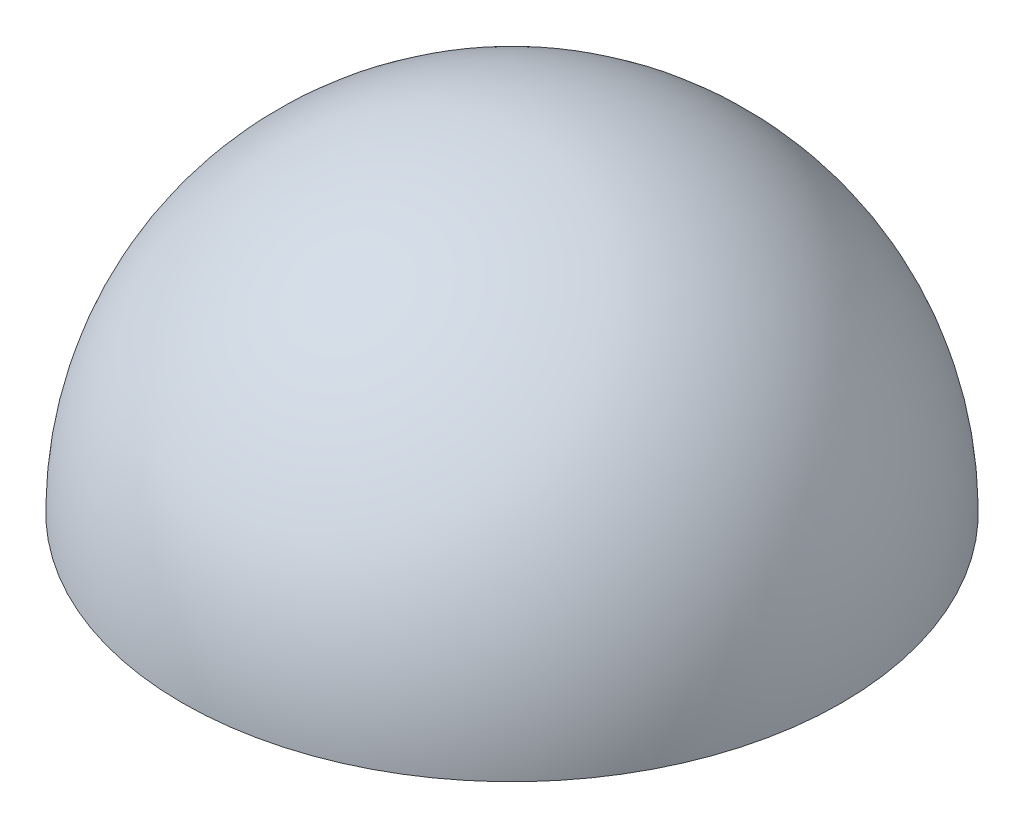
SolidWorks part; units mm, degrees
ref_plane "Front" through (0, 0, 0) normal (0, 0, 1) x (1, 0, 0)
ref_plane "Top" through (0, 0, 0) normal (0, 1, 0) x (1, 0, 0)
ref_plane "Right" through (0, 0, 0) normal (1, 0, 0) x (0, 0, -1)
sketch "Sketch1" plane through (0, 0, 0) normal (0, 0, 1) x (1, 0, 0)
  line L0 (0, 0) -> (0, -46.8792) construction
  line L1 (0, 0) -> (40.6911, 0)
  line L2 (0, 0) -> (0, 40.6911)
  arc A0 (40.6911, 0) -> (0, 40.6911) centre (0, 0) ccw
revolve "Revolve1" add sketch "Sketch1" angle 360 about L0
sketch "Sketch2" plane through (0, 0, 0) normal (0, -1, 0) x (1, 0, 0)
  line L3 (16.1696, -15.1011) -> (16.1696, 0)
  line L4 (21.2242, -15.1011) -> (21.2242, 0)
  dimension "D1" = 5.0546
sketch "Sketch3" plane through (0, 0, 0) normal (0, -1, 0) x (1, 0, 0)
  circle A0 centre (0, 0) radius 9.525
  dimension "D1" = 19.05
extrude "Cut-Extrude1" [suppressed] cut sketch "Sketch3" against normal through all
fillet "Fillet1" [suppressed] radius 1.27
sketch "Sketch4" plane through (0, 0, 0) normal (0, -1, 0) x (1, 0, 0)
  spline S0 degree 3 poles (-18.1264, -6.022) (-25.9066, 3.2605) (-17.262, 10.2949) (-9.2699, 18.1821) (1.6271, 8.4767) (12.4811, -7.3787) (-13.0948, -21.3852) (-18.1264, -6.022) (-25.9066, 3.2605) (-17.262, 10.2949) knots -0.471581 -0.243746 -0.0964 0 0.106179 0.218934 0.329879 0.528419 0.756254 0.9036 1 1.106179 1.218934 1.329879 only from (-23.4117, 2.8075) to (-23.4117, 2.8075)
